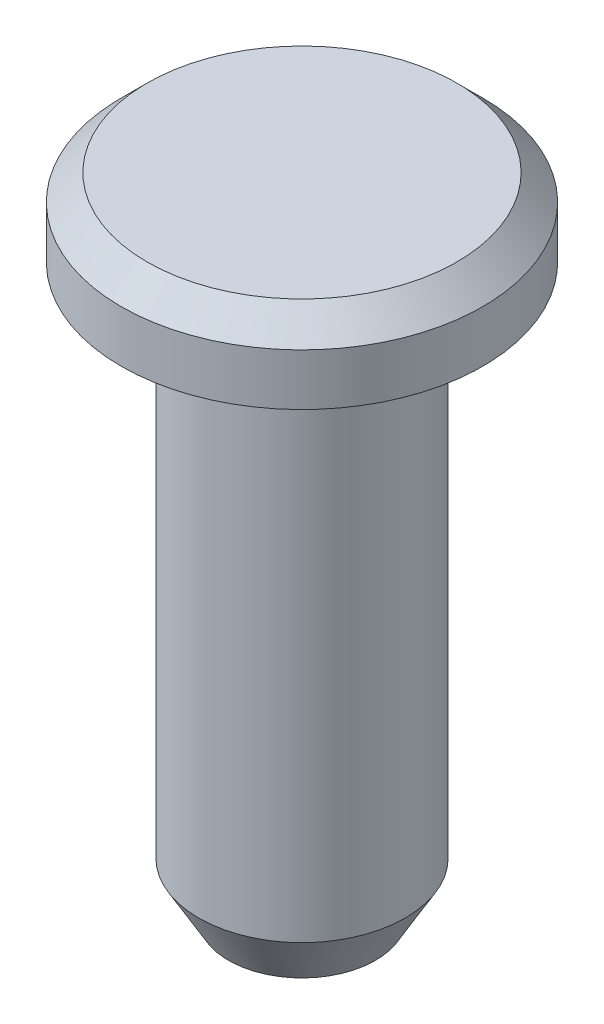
SolidWorks part; units mm, degrees
ref_plane "Płaszczyzna przednia" through (0, 0, 0) normal (0, 0, 1) x (1, 0, 0)
ref_plane "Płaszczyzna górna" through (0, 0, 0) normal (0, 1, 0) x (1, 0, 0)
ref_plane "Płaszczyzna prawa" through (0, 0, 0) normal (1, 0, 0) x (0, 0, -1)
sketch "Szkic1" plane through (0, 0, 0) normal (0, 0, 1) x (1, 0, 0)
  line L0 (0, 0) -> (-4, 0)
  line L2 (-4, 0) -> (-4, 22)
  line L3 (-4, 22) -> (-7, 22)
  line L4 (-7, 22) -> (-7, 25)
  line L6 (-7, 25) -> (0, 25)
  line L7 (0, 25) -> (0, 0)
  line L8 (0, 0) -> (0, -1.8347) construction
  dimension "dd" = 8
  dimension "D" = 14
  dimension "k" = 3
  dimension "L" = 22
revolve "Obrót1" add sketch "Szkic1" angle 360 about L8
chamfer "Sfazowanie1" distance 1 angle 45 1 edges at (0, 25, 7)
chamfer "Sfazowanie2" distance 2 angle 30 1 edges at (0, 0, 4)
